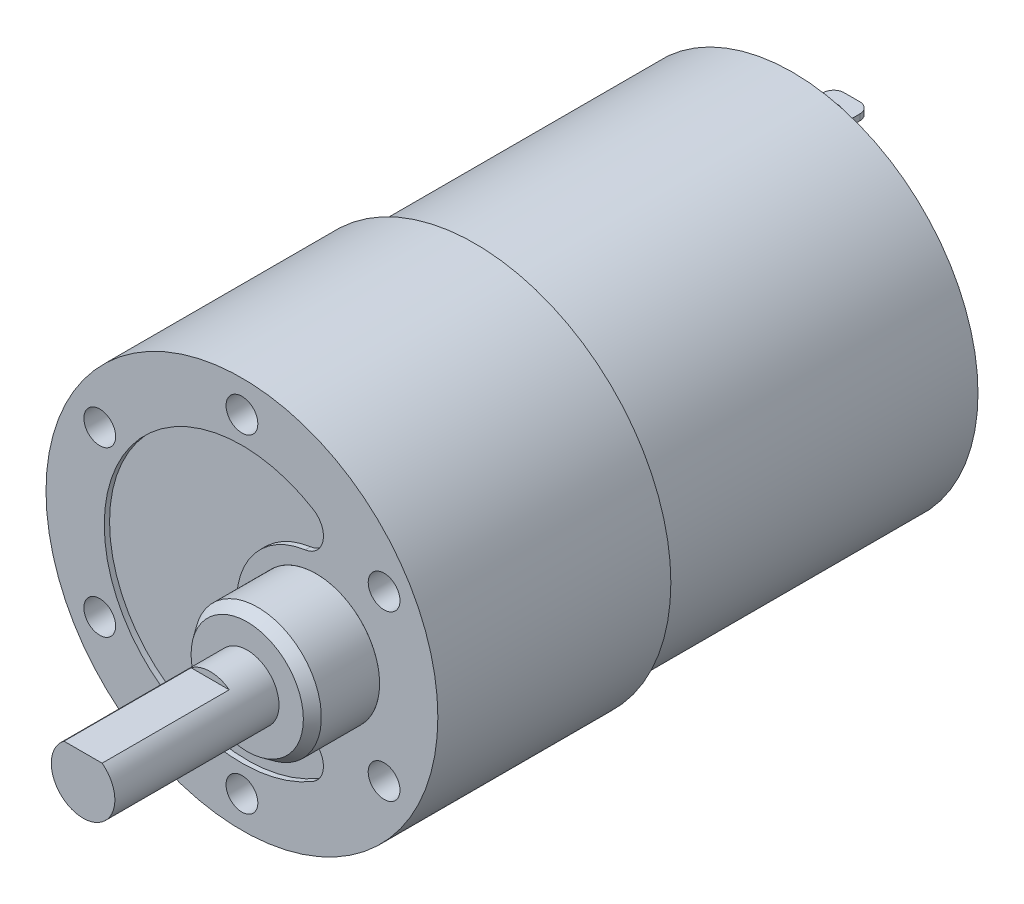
SolidWorks part; units mm, degrees
ref_plane "Front Plane" through (0, 0, 0) normal (0, 0, 1) x (1, 0, 0)
ref_plane "Top Plane" through (0, 0, 0) normal (0, 1, 0) x (1, 0, 0)
ref_plane "Right Plane" through (0, 0, 0) normal (1, 0, 0) x (0, 0, -1)
sketch "Sketch1" plane through (0, 0, 0) normal (0, 0, 1) x (1, 0, 0)
  circle A0 centre (0, 0) radius 18.5
  dimension "D1" = 37
extrude "Boss-Extrude1" add sketch "Sketch1" against normal blind 22
sketch "Sketch2" plane through (0, 0, -22) normal (0, 0, -1) x (-1, 0, 0)
  circle A0 centre (0, 0) radius 17.5
  dimension "D1" = 35
extrude "Boss-Extrude2" add sketch "Sketch2" along normal blind 30
sketch "Sketch3" plane through (0, 0, -52) normal (0, 0, -1) x (-1, 0, 0)
  circle A0 centre (0, 0) radius 4.5
  dimension "D1" = 9
extrude "Boss-Extrude3" add sketch "Sketch3" along normal blind 1
fillet "Fillet1" radius 1 1 edges at (-4.5, 0, -53)
sketch "Sketch4" plane through (0, 0, -52) normal (0, 0, -1) x (-1, 0, 0)
  line L1 (-1.7368, 12.657) -> (1.7368, 12.657)
  line L2 (-1.7368, 12.657) -> (-1.7368, 12.086)
  line L3 (-1.7368, 12.086) -> (1.7368, 12.086)
  line L4 (1.7368, 12.657) -> (1.7368, 12.086)
  line L5 (-1.7368, 12.657) -> (1.7368, 12.086) construction
  line L6 (-1.7368, 12.086) -> (1.7368, 12.657) construction
  point P0 (0, 12.3715)
extrude "Boss-Extrude4" add sketch "Sketch4" along normal blind 5.6
fillet "Fillet2" radius 1 2 edges at (-1.7368, 12.3715, -57.6) (1.7368, 12.3715, -57.6)
sketch "Sketch5" plane through (0, 12.657, 0) normal (0, 1, 0) x (1, 0, 0)
  circle A0 centre (0, 55.7146) radius 0.6187
extrude "Cut-Extrude1" cut sketch "Sketch5" against normal up to next
mirror "Mirror1" about plane through (0, 0, 0) normal (0, 1, 0) of "Cut-Extrude1", "Fillet2", "Boss-Extrude4"
sketch "Sketch6" plane through (0, 0, 0) normal (0, 0, 1) x (1, 0, 0)
  circle A0 centre (0, 0) radius 15.5 construction
  dimension "D1" = 31
sketch "Sketch7" plane through (0, 0, 0) normal (0, 0, 1) x (1, 0, 0)
  circle A0 centre (0, 15.5) radius 1.5
  circle A1 centre (0, 0) radius 15.5 construction
  dimension "D1" = 3
extrude "Cut-Extrude2" cut sketch "Sketch7" against normal blind 25.4
pattern_circular "CirPattern1" count 6 over 360 about axis through (0, 0, 0) along (0, 0, 1) of "Cut-Extrude2"
sketch "Sketch8" plane through (0, 0, 0) normal (0, 0, 1) x (1, 0, 0)
  circle A0 centre (7, 0) radius 6
  dimension "D1" = 12
  dimension "D2" = 7
extrude "Boss-Extrude5" add sketch "Sketch8" along normal blind 6.5
chamfer "Chamfer1" distance 1 angle 35 1 edges at (13, 0, 6.5)
sketch "Sketch9" plane through (0, 0, 6.5) normal (0, 0, 1) x (1, 0, 0)
  circle A0 centre (7, 0) radius 3
  dimension "D1" = 6
extrude "Boss-Extrude6" add sketch "Sketch9" along normal blind 15.5
sketch "Sketch10" plane through (0, 0, 22) normal (0, 0, 1) x (1, 0, 0)
  line L0 (7, -3) -> (7, 2.4) construction
  line L1 (4.4062, 2.4) -> (9.5938, 2.4)
  line L2 (4.4062, 2.4) -> (4.4062, 3.5726)
  line L3 (4.4062, 3.5726) -> (9.5938, 3.5726)
  line L4 (9.5938, 3.5726) -> (9.5938, 2.4)
  circle A0 centre (7, 0) radius 3 construction
  dimension "D1" = 5.4
extrude "Cut-Extrude3" cut sketch "Sketch10" against normal blind 12
sketch "Sketch11" plane through (0, 0, 0) normal (0, 0, 1) x (1, 0, 0)
  arc A0 (6.7321, 11.1211) -> (6.7321, -11.1211) centre (0, 0) ccw
  circle A1 centre (7, 0) radius 6 construction
  circle A2 centre (7, 0) radius 6
  arc A3 (5.9709, 7.4291) -> (5.9709, -7.4291) centre (7, 0) ccw
  circle A4 centre (7, 0) radius 7.5 construction
  arc A5 (5.9709, -7.4291) -> (6.7321, -11.1211) centre (5.6964, -9.4101) cw
  arc A6 (5.9709, 7.4291) -> (6.7321, 11.1211) centre (5.6964, 9.4101) ccw
  dimension "D2" = 2
  dimension "D1" = 1.5
extrude "Cut-Extrude4" cut sketch "Sketch11" against normal blind 0.5
